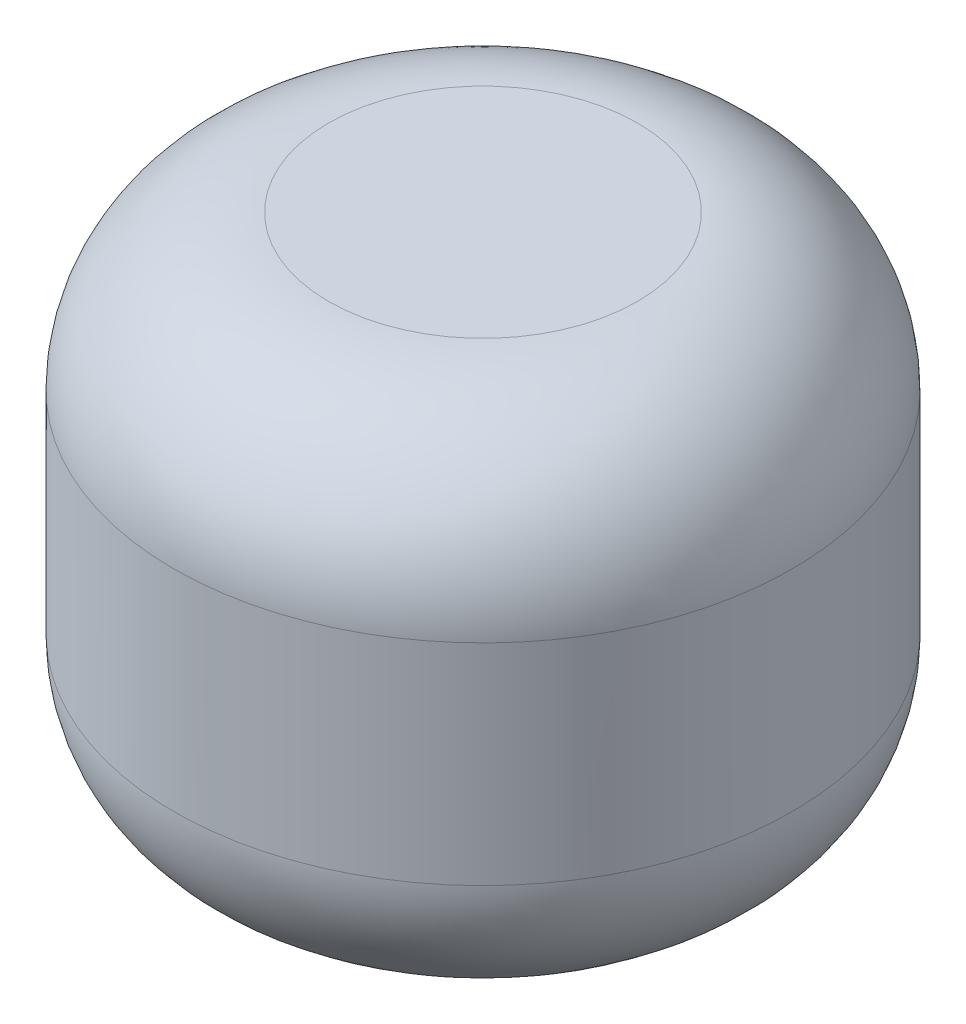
SolidWorks part; units mm, degrees
ref_plane "Front Plane" through (0, 0, 0) normal (0, 0, 1) x (1, 0, 0)
ref_plane "Top Plane" through (0, 0, 0) normal (0, 1, 0) x (1, 0, 0)
ref_plane "Right Plane" through (0, 0, 0) normal (1, 0, 0) x (0, 0, -1)
sketch "Sketch1" plane through (0, 0, 0) normal (0, 1, 0) x (1, 0, 0)
  circle A0 centre (0, 0) radius 6
  dimension "D1" = 12
extrude "Boss-Extrude1" add sketch "Sketch1" along normal mid plane 10
sketch "Sketch2" plane through (0, 0, 0) normal (0, 0, 1) x (1, 0, 0)
  line L0 (-4.2, -3) -> (4.2, -3)
  line L1 (0, -3) -> (0, -5) construction
  line L2 (-6, -5) -> (6, -5) construction
  arc A0 (-4.2, -3) -> (4.2, -3) centre (0, -3) cw
  dimension "D1" = 8.4
  dimension "D2" = 2
revolve "Cut-Revolve1" cut sketch "Sketch2" angle 360 about L0
fillet "Fillet1" radius 3 2 edges at (0, -5, 6) (0, 5, 6)
